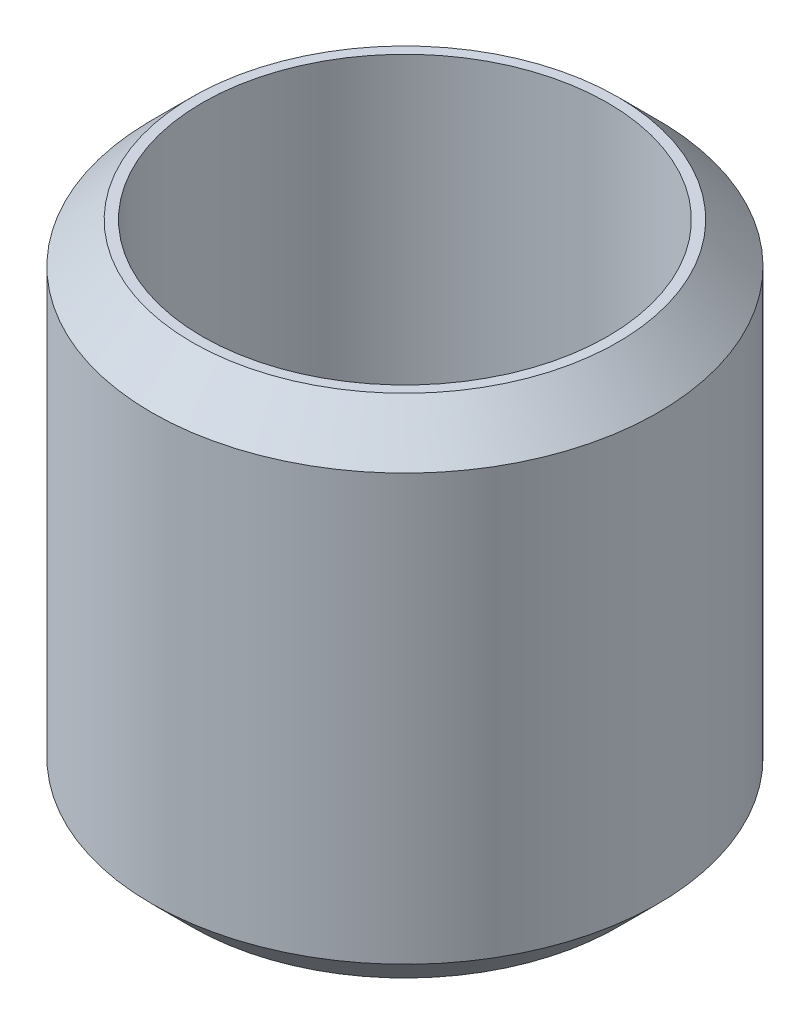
SolidWorks part; units mm, degrees
ref_plane "Front Plane" through (0, 0, 0) normal (0, 0, 1) x (1, 0, 0)
ref_plane "Top Plane" through (0, 0, 0) normal (0, 1, 0) x (1, 0, 0)
ref_plane "Right Plane" through (0, 0, 0) normal (1, 0, 0) x (0, 0, -1)
sketch "Sketch1" plane through (0, 0, 0) normal (0, 1, 0) x (1, 0, 0)
  circle A0 centre (0, 0) radius 10
  circle A1 centre (0, 0) radius 12.5
  dimension "D1" = 20
  dimension "D2" = 25
extrude "Boss-Extrude1" add sketch "Sketch1" along normal blind 25
chamfer "Chamfer1" distance 2 angle 45 2 edges at (0, 0, 12.5) (0, 25, 12.5)
